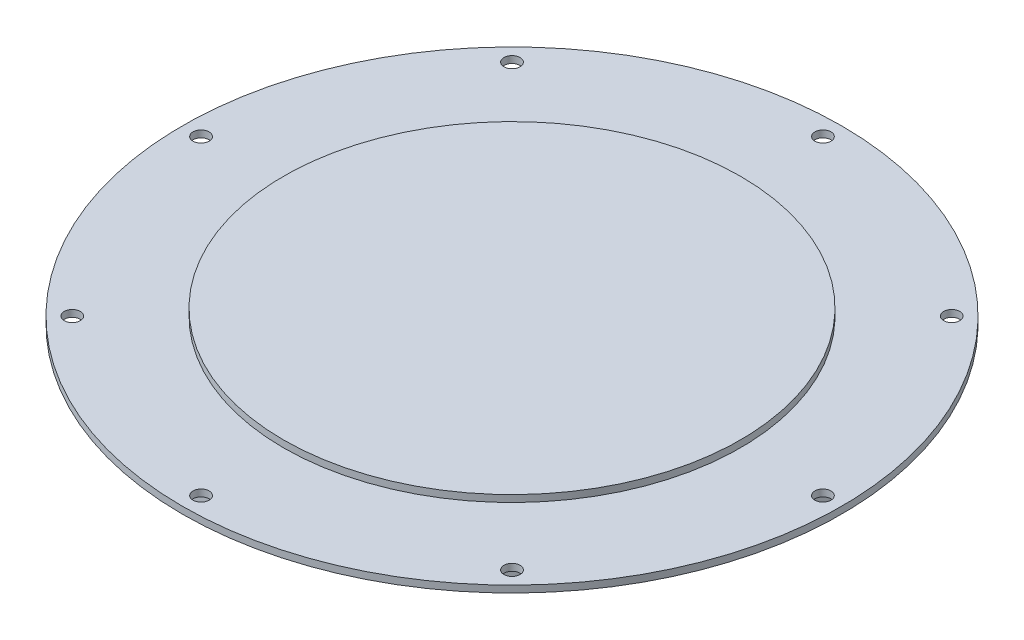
SolidWorks part; units mm, degrees
ref_plane "Front Plane" through (0, 0, 0) normal (0, 0, 1) x (1, 0, 0)
ref_plane "Top Plane" through (0, 0, 0) normal (0, 1, 0) x (1, 0, 0)
ref_plane "Right Plane" through (0, 0, 0) normal (1, 0, 0) x (0, 0, -1)
sketch "Sketch1" plane through (0, 0, 0) normal (0, 0, 1) x (1, 0, 0)
  line L0 (0, 3.048) -> (-101.2317, 3.048)
  line L1 (-101.2317, 3.048) -> (-101.2317, 0)
  line L2 (-109.5375, 838.2) -> (-109.5375, 3.5489) construction
  line L3 (-109.5375, -3.5489) -> (-109.5375, -12.3261)
  line L4 (-109.5375, -14.732) -> (0, -14.732)
  line L5 (0, -14.732) -> (0, 3.048)
  line L6 (0, 3.048) -> (0, 53.2697) construction
  line L7 (-103.3907, 0) -> (-128.7695, 0) construction
  line L8 (-101.3587, 838.2) -> (-101.3587, 0) construction
  line L9 (-109.2835, -12.894) -> (-108.2826, -12.894) construction
  line L11 (-109.5375, -13.462) -> (-109.5375, -14.732)
  line L12 (-101.2317, 0) -> (-103.3907, 0)
  line L13 (-103.3907, 0) -> (-109.5375, -3.5489)
  arc A0 (-109.5375, -12.3261) -> (-109.5375, -13.462) centre (-110.0455, -12.894) cw
  dimension "D5" = 0.762
  dimension "D1" = 17.78
  dimension "D2" = 3.048
  dimension "D3" = 0.127
  dimension "D4" = 30
  dimension "D6" = 1.27
  dimension "D7" = 0.254
revolve "Revolve1" add sketch "Sketch1" angle 360 about L6
fillet "Fillet1" radius 0.254 3 edges at (0, -12.3261, -109.5375) (0, -13.462, -109.5375) (0, -14.732, -109.5375)
sketch "Sketch2" plane through (0, 0, 0) normal (0, 0, 1) x (1, 0, 0)
  line L0 (-103.3907, 0) -> (-146.05, 0)
  line L1 (103.3907, 0) -> (-103.3907, 0) construction
  line L2 (-146.05, 0) -> (-146.05, -3.048)
  line L3 (-146.05, -3.048) -> (-127, -3.048)
  line L4 (-127, -3.048) -> (-127, -15.748)
  line L5 (-127, -15.748) -> (-125.73, -15.748)
  line L6 (0, 0) -> (0, -47.7276) construction
  line L7 (-125.73, -15.748) -> (-103.3907, -14.732)
  line L9 (-103.3907, -14.732) -> (-103.3907, 0)
  line L10 (-109.2835, -14.732) -> (109.2835, -14.732) construction
  dimension "D1" = 3.048
  dimension "D2" = 254
  dimension "D3" = 12.7
  dimension "D4" = 1.27
  dimension "D5" = 19.05
revolve "Revolve2" add sketch "Sketch2" angle 360 about L6
hole_wizard "9/32 (0.28125) Diameter Hole1" positions "Sketch4" profile "Sketch3" hole size "9/32" standard "ANSI Inch"
sketch "Sketch4" plane through (0, -3.048, 0) normal (0, -1, 0) x (-1, 0, 0)
  line L0 (127, 0) -> (146.05, 0) construction
  circle A0 centre (0, 0) radius 127 construction
  circle A1 centre (0, 0) radius 127 construction
  circle A2 centre (0, 0) radius 146.05 construction
  circle A3 centre (137.795, 0) radius 6.985 construction
  point P0 (137.795, 0)
  dimension "D1" = 13.97
  dimension "D2" = 3.81
sketch "Sketch3" plane through (-137.795, -3.048, 0) normal (1, 0, 0) x (0, 0, -1)
  line L0 (0, 0) -> (0, 6.096)
  line L1 (0, 6.096) -> (3.5719, 6.096)
  line L2 (3.5719, 6.096) -> (3.5719, 0)
  line L5 (3.5719, 0) -> (0, 0)
  line L11 (0, -6.35) -> (0, 107.95) construction
  dimension "Thru Hole Dia." = 7.1437
  dimension "Thru Hole Depth" = 6.096
pattern_circular "CirPattern1" count 8 over 360 about axis through (0, 0, 0) along (0, 1, 0) of "9/32 (0.28125) Diameter Hole1"
